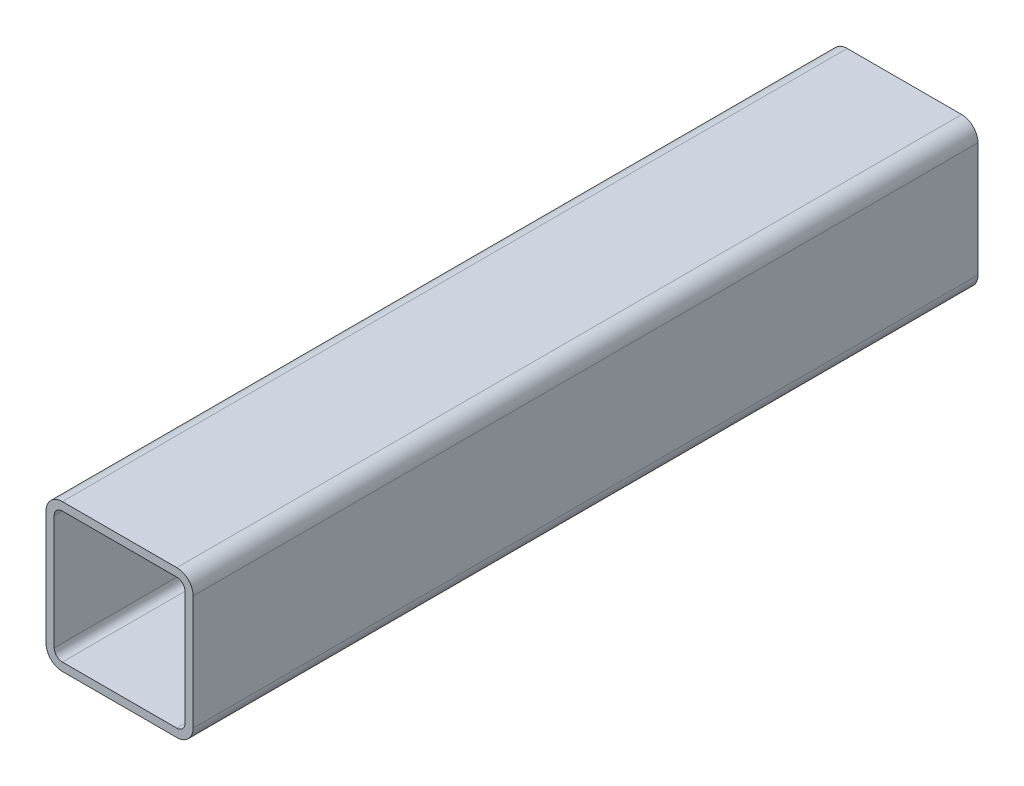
SolidWorks part; units mm, degrees
ref_plane "Front Plane" through (0, 0, 0) normal (0, 0, 1) x (1, 0, 0)
ref_plane "Top Plane" through (0, 0, 0) normal (0, 1, 0) x (1, 0, 0)
ref_plane "Right Plane" through (0, 0, 0) normal (1, 0, 0) x (0, 0, -1)
sketch "Sketch1" plane through (0, 0, 0) normal (0, 0, 1) x (1, 0, 0)
sketch_block_instance "HSS2.25x2.25x0.125-1"
sketch_block "HSS2.25x2.25x0.125"
extrude "Boss-Extrude1" add sketch "Sketch1" along normal blind 304.8
